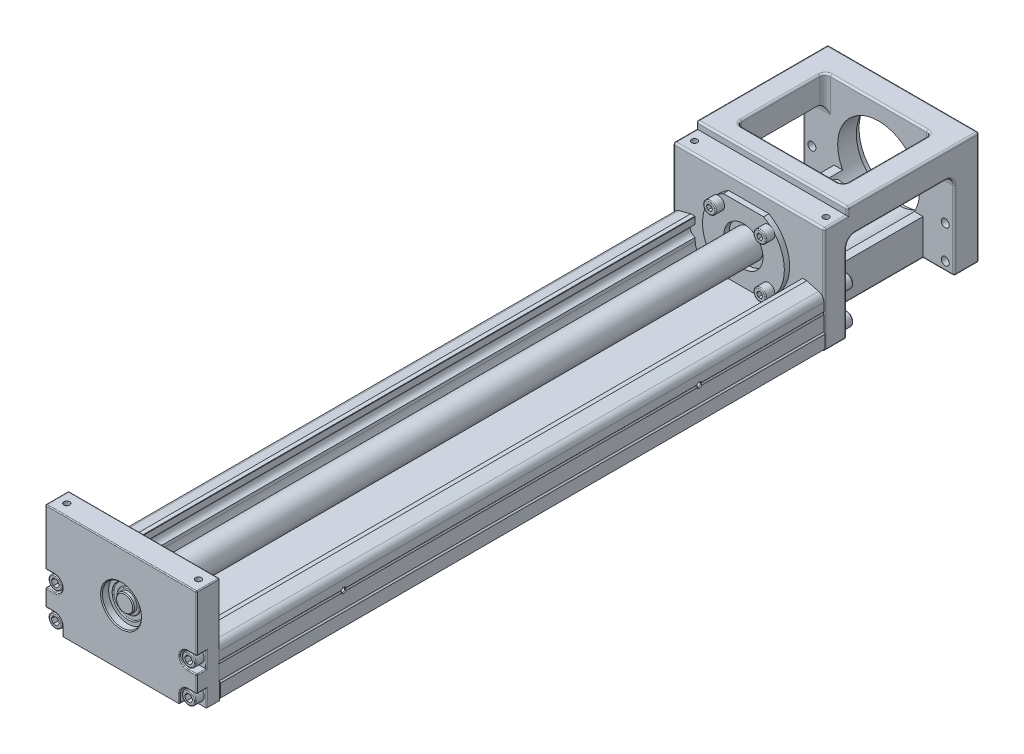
SolidWorks part; units mm, degrees
ref_plane "前视基准面" through (0, 0, 0) normal (0, 0, 1) x (1, 0, 0)
ref_plane "上视基准面" through (0, 0, 0) normal (0, 1, 0) x (1, 0, 0)
ref_plane "右视基准面" through (0, 0, 0) normal (1, 0, 0) x (0, 0, -1)
sketch "草图1" plane through (0, 0, 0) normal (0, 0, 1) x (1, 0, 0)
  line L0 (0, 0) -> (0, 14.97) construction
  line L1 (-11, 0.5) -> (11, 0.5)
  line L2 (11, 0.5) -> (11, 0)
  line L3 (11, 0) -> (33, 0) construction
  line L4 (33, 0) -> (33, 0.5)
  line L5 (33, 0.5) -> (41.5, 0.5)
  line L6 (43, 2) -> (43, 9.25) construction
  line L7 (43, 9.25) -> (42.25, 10)
  line L8 (42.25, 10) -> (42.25, 24.345)
  line L9 (39.2853, 28.2087) -> (32.6, 30)
  line L10 (32.6, 30) -> (30.1, 30) construction
  line L11 (30.1, 30) -> (30.1, 17.9)
  line L12 (30.1, 30) -> (30.1, 30.15)
  line L13 (13, 9.9) -> (-13, 9.9)
  line L14 (41.5, 0.5) -> (43, 2)
  line L15 (-41.5, 0.5) -> (-43, 2)
  line L16 (30.1, 30.15) -> (32.0402, 30.15)
  line L17 (-30.1, 30) -> (-30.1, 17.9)
  line L18 (-32.6, 30) -> (-30.1, 30) construction
  line L19 (-39.2853, 28.2087) -> (-32.6, 30)
  line L20 (-42.25, 10) -> (-42.25, 24.345)
  line L21 (-43, 9.25) -> (-42.25, 10)
  line L22 (-43, 2) -> (-43, 9.25) construction
  line L23 (-33, 0.5) -> (-41.5, 0.5)
  line L24 (-33, 0) -> (-33, 0.5)
  line L25 (-11, 0) -> (-33, 0) construction
  line L26 (-11, 0.5) -> (-11, 0)
  line L27 (13, 9.9) -> (22.1, 9.9)
  line L28 (32.0402, 30.15) -> (32.6, 30)
  line L29 (-13, 9.9) -> (-22.1, 9.9)
  line L30 (43, 9.25) -> (43.15, 9.1)
  line L31 (43.15, 9.1) -> (43.15, 2.15)
  line L32 (43.15, 2.15) -> (43, 2)
  line L33 (33, 0) -> (33, -0.5)
  line L34 (33, -0.5) -> (11, -0.5)
  line L35 (11, -0.5) -> (11, 0)
  line L36 (-11, -0.5) -> (-11, 0)
  line L37 (-33, -0.5) -> (-11, -0.5)
  line L38 (-33, 0) -> (-33, -0.5)
  line L39 (-43.15, 2.15) -> (-43, 2)
  line L40 (-43.15, 9.1) -> (-43.15, 2.15)
  line L41 (-43, 9.25) -> (-43.15, 9.1)
  line L42 (-30.1, 30) -> (-30.1, 30.15)
  line L43 (-30.1, 30.15) -> (-32.0402, 30.15)
  line L44 (-32.0402, 30.15) -> (-32.6, 30)
  arc A0 (42.25, 24.345) -> (39.2853, 28.2087) centre (38.25, 24.345) ccw
  arc A1 (-22.1, 9.9) -> (-30.1, 17.9) centre (-22.1, 17.9) cw
  arc A2 (22.1, 9.9) -> (30.1, 17.9) centre (22.1, 17.9) ccw
  arc A3 (-42.25, 24.345) -> (-39.2853, 28.2087) centre (-38.25, 24.345) cw
  point P9 (43, 0.5)
  point P24 (0, 0.5)
  point P25 (0, 9.9)
  point P40 (-43, 0.5)
  dimension "D16" = 4
  dimension "D17" = 13
  dimension "D15" = 8
  dimension "D1" = 0.5
  dimension "D2" = 0.5
  dimension "D3" = 43
  dimension "D4" = 42.25
  dimension "D5" = 2.5
  dimension "D6" = 30
  dimension "D7" = 15
  dimension "D8" = 9.4
  dimension "D9" = 22
  dimension "D10" = 11
  dimension "D11" = 10
  dimension "D12" = 45
  dimension "D13" = 30.1
  dimension "D14" = 13
  dimension "D19" = 22.1
  dimension "D20" = 22.1
  dimension "D21" = 0.5
  dimension "D22" = 0.15
  dimension "D23" = 0.15
extrude "总长" add sketch "草图1" along normal blind 340
sketch "草图2" plane through (0, 0, 0) normal (0, 0, -1) x (-1, 0, 0)
  line L0 (-33.1974, 23) -> (30.685, 23) construction
  line L1 (0, 0) -> (0, 24.2172) construction
  line L2 (-29.7, 23) -> (-31.9451, 25.2451) construction
  line L4 (-22.1, 9.9) -> (22.1, 9.9) construction
  line L5 (-30.1, 30.15) -> (-30.1, 17.9) construction
  line L6 (-32.8, 22.7) -> (-32.8, 23.3)
  line L7 (-32.6, 23.5) -> (-32.3495, 23.5)
  line L8 (-29.6116, 22.9116) -> (-32.6, 23.3) construction
  line L9 (-32.6, 23.3) -> (-32.8841, 23.3369) construction
  line L10 (-32.6, 22.5) -> (-32.3495, 22.5)
  line L11 (32.6, 22.5) -> (32.3495, 22.5)
  line L12 (32.8, 22.7) -> (32.8, 23.3)
  line L13 (32.6, 23.5) -> (32.3495, 23.5)
  circle A0 centre (-29.7, 23) radius 3.175 construction
  arc A1 (-26.3128, 23) -> (-32.9104, 23) centre (-29.6116, 22.9116) ccw construction
  arc A2 (-26.3128, 23) -> (-32.9104, 23) centre (-29.6116, 23.0884) cw construction
  arc A3 (26.3128, 23) -> (32.9104, 23) centre (29.6116, 23.0884) ccw construction
  arc A4 (26.3128, 23) -> (32.9104, 23) centre (29.6116, 22.9116) cw construction
  arc A5 (-32.3495, 22.5) -> (-32.3495, 23.5) centre (-29.9, 23) ccw
  arc A6 (-32.8, 23.3) -> (-32.6, 23.5) centre (-32.6, 23.3) cw
  arc A7 (-32.8, 22.7) -> (-32.6, 22.5) centre (-32.6, 22.7) ccw
  arc A8 (32.8, 22.7) -> (32.6, 22.5) centre (32.6, 22.7) cw
  arc A9 (32.8, 23.3) -> (32.6, 23.5) centre (32.6, 23.3) ccw
  arc A10 (32.3495, 22.5) -> (32.3495, 23.5) centre (29.9, 23) cw
  point P20 (-31.5649, 24.8649)
  point P21 (-30.1, 26.1753)
  point P22 (-30.1, 25.492)
  point P31 (-32.7983, 23.3258)
  point P33 (-32.8, 23)
  dimension "D2" = 6.35
  dimension "D5" = 6.6
  dimension "D6" = 5
  dimension "D10" = 0.2
  dimension "D1" = 13.1
  dimension "D3" = 59.4
  dimension "D4" = 45
  dimension "D7" = 59.8
  dimension "D8" = 0.5376
  dimension "D9" = 0.6833
  dimension "D11" = 1
  dimension "D12" = 65.6
  dimension "D13" = 0.0865
extrude "预拉滚道" cut sketch "草图2" against normal through all
hole_wizard "cekong" positions "草图4" profile "草图3" tap size "M2.5" standard "GB"
sketch "草图4" plane through (-42.25, 0, 0) normal (-1, 0, 0) x (0, 0, 1)
  line L2 (0, 24.345) -> (0, 10) construction
  point P0 (70, 19)
  dimension "D3" = 19
  dimension "ckdj" = 70
sketch "草图3" plane through (-42.25, 19, 70) normal (0, 1, 0) x (0, 0, 1)
  line L0 (0, 0) -> (0, 6.1159)
  line L1 (0, 6.1159) -> (1.025, 5.5)
  line L2 (1.025, 5.5) -> (1.025, 0.475)
  line L3 (1.025, 0.475) -> (1.5, 0)
  line L5 (1.5, 0) -> (0, 0)
  line L6 (-1.025, 0.475) -> (-1.5, 0) construction
  line L10 (0, 6.1159) -> (-1.025, 5.5) construction
  line L11 (0, -6.35) -> (0, 107.95) construction
  dimension "螺纹孔钻头直径" = 2.05
  dimension "螺纹孔钻头深度" = 5.5
  dimension "近端锥形沉头孔直径" = 3
  dimension "近端锥形沉头孔角度" = 90
  dimension "导头角度" = 118
pattern_linear "ckzl" count 2 spacing 200 along (0, 0, 1) of "cekong"
mirror "镜向3" about plane through (0, 0, 0) normal (1, 0, 0) of "ckzl", "cekong"
hole_wizard "dikong" positions "草图6" profile "草图5" counterbore size "M6" standard "GB"
sketch "草图6" plane through (6.505, 30.15, 0) normal (0, 1, 0) x (1, 0, 0)
  line L1 (15.595, 0) -> (-28.605, 0) construction
  point P0 (-29.505, -70)
  dimension "D2" = 23
  dimension "dkdj" = 70
sketch "草图5" plane through (-23, 30.15, 70) normal (1, 0, 0) x (0, 0, 1)
  line L0 (0, 0) -> (0, 30.65)
  line L1 (3.3, 29.95) -> (4, 30.65)
  line L2 (3.3, 29.95) -> (3.3, 25.65)
  line L3 (3.3, 25.65) -> (5.5, 25.65)
  line L4 (5.5, 25.65) -> (5.5, 0)
  line L5 (5.5, 0) -> (0, 0)
  line L11 (0, -6.35) -> (0, 107.95) construction
  line L12 (4, 30.65) -> (0, 30.65)
  line L13 (-3.3, 29.95) -> (-4, 30.65) construction
  dimension "通孔孔直径" = 6.6
  dimension "通孔孔深度" = 30.65
  dimension "柱形沉头孔直径" = 11
  dimension "柱形沉头孔深度" = 25.65
  dimension "远端锥形沉头孔直径" = 8
  dimension "远端锥形沉头孔角度" = 90
pattern_linear "dkzl" count 3 spacing 100 along (0, 0, 1) count 2 spacing 46 along (1, 0, 0) of "dikong"
ref_plane "基准面1" through (0, 0, 170) normal (0, 0, 1) x (1, 0, 0)
sketch "草图9" plane through (0, 0, 0) normal (0, 0, -1) x (-1, 0, 0)
  line L0 (42.25, 24.345) -> (42.25, 10) construction
  line L2 (0, 0) -> (0, 25.541) construction
  line L3 (36.1341, 19) -> (47.0239, 19) construction
  line L5 (40.5408, 6) -> (48.9402, 6) construction
  line L8 (42.7, 5.25) -> (51.3153, 5.25)
  line L9 (42.5, 5.45) -> (42.5, 6.55)
  line L10 (42.7, 6.75) -> (51.3153, 6.75)
  line L11 (51.3153, 5.25) -> (51.3153, 6.75)
  line L12 (42.5, 5.25) -> (51.3153, 6.75) construction
  line L13 (42.5, 6.75) -> (51.3153, 5.25) construction
  circle A0 centre (43.6, 6) radius 1 construction
  circle A1 centre (42.95, 19) radius 1
  circle A2 centre (-42.95, 19) radius 1
  arc A3 (42.7, 5.25) -> (42.5, 5.45) centre (42.7, 5.45) cw
  arc A4 (42.5, 6.55) -> (42.7, 6.75) centre (42.7, 6.55) cw
  point P20 (46.9077, 6)
  dimension "D1" = 2
  dimension "D4" = 2
  dimension "D8" = 0.2
  dimension "D2" = 87.2
  dimension "D3" = 13
  dimension "D5" = 0.7
  dimension "D6" = 1.5
  dimension "D7" = 85
extrude "标识槽" cut sketch "草图9" against normal through all
chamfer "倒角1" distance 0.35 angle 45 2 edges at (-30.1, 30.15, 170) (30.1, 30.15, 170)
chamfer "倒角2" distance 1 angle 45 4 edges at (-11, -0.5, 170) (-33, -0.5, 170) (11, -0.5, 170) (33, -0.5, 170)
sketch "草图11" plane through (0, 0, 0) normal (0, 0, -1) x (-1, 0, 0)
  line L0 (-32.0402, 30.15) -> (-30.45, 30.15) construction
  line L1 (-43, 30) -> (43, 30)
  line L2 (-43, 30) -> (-43, 0)
  line L3 (-43, 0) -> (43, 0)
  line L4 (43, 30) -> (43, 0)
  line L5 (-43.15, 2.15) -> (-43.15, 9.1) construction
  line L6 (43.15, 5.25) -> (43.15, 2.15) construction
  line L7 (32, -0.5) -> (12, -0.5) construction
  dimension "D1" = 0.15
  dimension "D2" = 0.15
  dimension "D3" = 0.15
  dimension "D4" = 0.5
extrude "切除-拉伸3" cut sketch "草图11" against normal through all flip side to cut
sketch "草图12" plane through (0, 0, 0) normal (0, 0, -1) x (-1, 0, 0)
  line L0 (0, 0) -> (0, 23) construction
  line L1 (0, 23) -> (-51.3359, 23) construction
  line L2 (-32.5, 0) -> (-11.5, 0) construction
  line L3 (-29.7, 23) -> (-31.9451, 25.2451)
  circle A0 centre (-29.7, 23) radius 3.175 construction
  arc A1 (-26.2025, 23) -> (-32.9281, 23) centre (-29.5653, 22.8653) ccw
  arc A2 (-26.2025, 23) -> (-32.9281, 23) centre (-29.5653, 23.1347) cw
  arc A3 (26.2025, 23) -> (32.9281, 23) centre (29.5653, 22.8653) cw
  arc A4 (26.2025, 23) -> (32.9281, 23) centre (29.5653, 23.1347) ccw
extrude "切除-拉伸4" cut sketch "草图12" against normal through all
sketch "草图13" plane through (0, 0, 0) normal (0, 0, -1) x (-1, 0, 0)
  line L0 (0, 0) -> (0, 45.4622) construction
  line L1 (-42.5, 64) -> (42.5, 64)
  line L2 (-42.5, 64) -> (-42.5, 0.5)
  line L3 (-42.5, 0.5) -> (42.5, 0.5)
  line L4 (42.5, 64) -> (42.5, 0.5)
  line L5 (11, 0.5) -> (-11, 0.5) construction
  dimension "D1" = 85
  dimension "D2" = 63.5
extrude "凸台-拉伸1" add sketch "草图13" along normal blind 87 separate body
sketch "草图15" plane through (42.5, 0, 0) normal (1, 0, 0) x (0, 0, -1)
  line L0 (0, 64) -> (0, 0.5) construction
  line L1 (12.5, 0.5) -> (73, 0.5)
  line L3 (12.5, 49.5) -> (73, 49.5)
  line L4 (73, 0.5) -> (73, 49.5)
  line L6 (12.5, 0.5) -> (12.5, 49.5)
  line L8 (87, 0.5) -> (0, 0.5) construction
  point P0 (23, 0.5)
  point P2 (23, 49.5)
  point P9 (15, 49.5)
  point P10 (15, 54.7868)
  point P11 (73, 30.5)
  dimension "D1" = 12.5
  dimension "D2" = 60.5
  dimension "D3" = 49
extrude "切除-拉伸5" cut sketch "草图15" against normal blind 17.5
sketch "草图16" plane through (-42.5, 0, 0) normal (-1, 0, 0) x (0, 0, 1)
  line L6 (-73, 49.5) -> (-73, 0.5)
  line L7 (-12.5, 49.5) -> (-73, 49.5)
  line L10 (-12.5, 0.5) -> (-12.5, 49.5)
  line L11 (-73, 0.5) -> (-12.5, 0.5)
  line L12 (-73, 49.5) -> (-73, 0.5)
  line L13 (-12.5, 49.5) -> (-73, 49.5)
  line L16 (-12.5, 0.5) -> (-12.5, 49.5)
  line L17 (-73, 0.5) -> (-12.5, 0.5)
  dimension "D1" = 0
extrude "切除-拉伸6" cut sketch "草图16" against normal blind 17.5
sketch "草图18" plane through (0, 0, -87) normal (0, 0, -1) x (-1, 0, 0)
  line L0 (0, 0) -> (0, 32) construction
  circle A0 centre (0, 32) radius 23
  dimension "D1" = 46
  dimension "D2" = 32
extrude "切除-拉伸7" cut sketch "草图18" against normal blind 64
sketch "草图19" plane through (0, 0, -87) normal (0, 0, -1) x (-1, 0, 0)
  circle A0 centre (0, 32) radius 25
  dimension "D1" = 50
extrude "切除-拉伸8" cut sketch "草图19" against normal blind 3.5
sketch "草图20" plane through (0, 64, 0) normal (0, 1, 0) x (1, 0, 0)
  line L0 (0, 87) -> (0, -17.8608) construction
  line L1 (-42.5, 87) -> (42.5, 87) construction
  line L2 (-25, 73) -> (-42.5, 73) construction
  line L3 (-30, 73) -> (30, 73)
  line L4 (-30, 73) -> (-30, 23)
  line L5 (-30, 23) -> (30, 23)
  line L6 (30, 73) -> (30, 23)
  line L7 (23, 23) -> (-23, 23) construction
  dimension "D1" = 60
extrude "切除-拉伸9" cut sketch "草图20" against normal blind 43
fillet "圆角1" radius 3 4 edges at (-30, 56.75, -23) (-30, 56.75, -73) (30, 56.75, -73) (30, 56.75, -23)
fillet "圆角2" radius 5 4 edges at (34.75, 49.5, -73) (-34.75, 49.5, -73) (33.75, 49.5, -12.5) (-33.75, 49.5, -12.5)
sketch "草图22" plane through (42.5, 0, 0) normal (1, 0, 0) x (0, 0, -1)
  line L1 (0, 64) -> (13, 64)
  line L2 (0, 64) -> (0, 60)
  line L3 (0, 60) -> (13, 60)
  line L4 (13, 64) -> (13, 60)
  dimension "D1" = 13
  dimension "D2" = 4
extrude "切除-拉伸10" cut sketch "草图22" against normal through all
sketch "草图23" plane through (0, 0, -23) normal (0, 0, -1) x (-1, 0, 0)
  circle A0 centre (0, 32) radius 11
  dimension "D1" = 22
extrude "切除-拉伸11" cut sketch "草图23" against normal blind 5.5
sketch "草图24" plane through (0, 0, -17.5) normal (0, 0, -1) x (-1, 0, 0)
  circle A0 centre (0, 32) radius 8.5
  dimension "D1" = 17
extrude "凸台-拉伸3" add sketch "草图24" along normal blind 6
sketch "草图25" plane through (0, 0, -23.5) normal (0, 0, -1) x (-1, 0, 0)
  circle A0 centre (0, 32) radius 6
  dimension "D1" = 12
extrude "凸台-拉伸4" add sketch "草图25" along normal blind 7.5
sketch "草图26" plane through (0, 0, -23.5) normal (0, 0, -1) x (-1, 0, 0)
  line L0 (0, 32) -> (0, 49.8509) construction
  line L1 (-2.7964, 42.6386) -> (-10.6386, 34.7964)
  line L2 (-10.6386, 29.2036) -> (-2.7964, 21.3614)
  line L3 (2.7964, 21.3614) -> (10.6386, 29.2036)
  line L4 (10.6386, 34.7964) -> (2.7964, 42.6386)
  circle A0 centre (0, 32) radius 9.5 construction
  arc A1 (-10.6386, 34.7964) -> (-10.6386, 29.2036) centre (0, 32) ccw
  arc A4 (-2.7964, 21.3614) -> (2.7964, 21.3614) centre (0, 32) ccw
  arc A5 (10.6386, 29.2036) -> (10.6386, 34.7964) centre (0, 32) ccw
  arc A6 (2.7964, 42.6386) -> (-2.7964, 42.6386) centre (0, 32) ccw
  point P14 (-1.5, 41)
  point P15 (-1.5, 21)
  point P18 (1.5, 41)
  point P19 (1.5, 21)
  dimension "D1" = 19
  dimension "D2" = 22
extrude "凸台-拉伸5" add sketch "草图26" along normal blind 6.5 separate body
sketch "草图27" plane through (0, 0, -31) normal (0, 0, -1) x (-1, 0, 0)
  circle A0 centre (0, 32) radius 5
  dimension "D1" = 10
extrude "凸台-拉伸6" add sketch "草图27" along normal blind 20
fillet "圆角3" radius 1 42 edges at (42.5, 22.5, -12.5) (42.5, 49.5, -42.75) (42.5, 48.0355, -71.5355) (-42.5, 22.5, -12.5) (-42.5, 49.5, -42.75) (-42.5, 48.0355, -71.5355) (-42.5, 30.25, 0) (42.5, 30.25, 0) (42.5, 0.5, -6.25) (-42.5, 0.5, -6.25) (-42.5, 0.5, -80) (42.5, 0.5, -80) (0, 0.5, -87) (42.5, 22.5, -73) (42.5, 32.25, -87) (-42.5, 22.5, -73) (-42.5, 32.25, -87) (42.5, 60, -6.5) (42.5, 62, -13) (0, 60, 0) (0, 64, -13) (-42.5, 62, -13) (-42.5, 60, -6.5) (-42.5, 64, -50) (0, 64, -87) (42.5, 64, -50) (-33.75, 0.5, -12.5) (-25, 0.5, -42.75) (-33.75, 0.5, -73) (33.75, 0.5, -73) (25, 0.5, -42.75) (33.75, 0.5, -12.5) (42.5, 48.0355, -13.9645) (-42.5, 48.0355, -13.9645) (29.1213, 64, -23.8787) (0, 64, -23) (-29.1213, 64, -23.8787) (-30, 64, -48) (-29.1213, 64, -72.1213) (0, 64, -73) (29.1213, 64, -72.1213) (30, 64, -48)
sketch "草图28" plane through (0, 0, 340) normal (0, 0, 1) x (1, 0, 0)
  line L0 (-41.5, 0.5) -> (-33, 0.5) construction
  line L1 (-42.5, 0.5) -> (42.5, 0.5)
  line L2 (-42.5, 0.5) -> (-42.5, 60)
  line L3 (-42.5, 60) -> (42.5, 60)
  line L4 (42.5, 0.5) -> (42.5, 60)
  line L5 (-42.5, 1.5) -> (-42.5, 59) construction
  line L6 (-41.5, 60) -> (41.5, 60) construction
  line L7 (42.5, 59) -> (42.5, 1.5) construction
extrude "凸台-拉伸7" add sketch "草图28" along normal blind 13
hole_wizard "M4 螺纹孔1" positions "草图30" profile "草图29" tap size "M4" standard "GB"
sketch "草图30" plane through (0, 60, 0) normal (0, 1, 0) x (1, 0, 0)
  line L0 (0, 86) -> (0, -353) construction
  line L1 (41.5, 86) -> (-41.5, 86) construction
  line L2 (42.5, -353) -> (-42.5, -353) construction
  line L4 (-41.5, 13) -> (41.5, 13) construction
  point P0 (-37, -346.5)
  point P2 (37, -346.5)
  point P4 (-37, 6.5)
  point P6 (37, 6.5)
  dimension "D1" = 74
  dimension "D2" = 6.5
  dimension "D3" = 6.5
sketch "草图29" plane through (-37, 60, 346.5) normal (1, 0, 0) x (0, 0, 1)
  line L0 (0, 0) -> (0, 11.0914)
  line L1 (0, 11.0914) -> (1.65, 10.1)
  line L2 (1.65, 10.1) -> (1.65, 0)
  line L5 (1.65, 0) -> (0, 0)
  line L10 (0, 11.0914) -> (-1.65, 10.1) construction
  line L11 (0, -6.35) -> (0, 107.95) construction
  dimension "螺纹孔钻头直径" = 3.3
  dimension "螺纹孔钻头深度" = 10.1
  dimension "导头角度" = 118
sketch "草图32" plane through (0, 0, 0) normal (0, 0, 1) x (1, 0, 0)
  circle A0 centre (0, 32) radius 8
  dimension "D1" = 16
extrude "凸台-拉伸8" add sketch "草图32" along normal up to surface (340 mm away)
sketch "草图33" plane through (0, 0, 353) normal (0, 0, 1) x (1, 0, 0)
  circle A0 centre (0, 32) radius 11
extrude "切除-拉伸12" cut sketch "草图33" against normal blind 4
sketch "草图34" plane through (0, 0, 349) normal (0, 0, 1) x (1, 0, 0)
  circle A0 centre (0, 32) radius 5
  dimension "D1" = 10
extrude "凸台-拉伸9" add sketch "草图34" along normal blind 2
sketch "草图35" plane through (0, 0, 353) normal (0, 0, 1) x (1, 0, 0)
  line L0 (0, 32) -> (0, 0) construction
  line L1 (-11.5, 0) -> (-32.5, 0) construction
  line L2 (-42.5, 60) -> (-42.5, 0.5) construction
  line L3 (42.5, 0.5) -> (42.5, 60) construction
  line L4 (-42.5, 28.5) -> (-42.5, 19.5)
  line L5 (42.5, 0.5) -> (42.5, 10)
  line L6 (-37.5, 28.5) -> (-42.5, 28.5)
  line L7 (-37.5, 19.5) -> (-42.5, 19.5)
  line L8 (-37.5, 10) -> (-42.5, 10)
  line L9 (-33, 5.5) -> (-33, 0.5)
  line L10 (-42.5, 0.5) -> (-33, 0.5)
  line L11 (-42.5, 10) -> (-42.5, 0.5)
  line L12 (37.5, 28.5) -> (42.5, 28.5)
  line L13 (37.5, 19.5) -> (42.5, 19.5)
  line L14 (37.5, 10) -> (42.5, 10)
  line L15 (33, 5.5) -> (33, 0.5)
  line L16 (33, 0.5) -> (42.5, 0.5)
  line L17 (-42.5, 0.5) -> (42.5, 0.5) construction
  line L18 (42.5, 19.5) -> (42.5, 28.5)
  arc A0 (-37.5, 19.5) -> (-37.5, 28.5) centre (-37.5, 24) ccw
  arc A1 (-33, 5.5) -> (-37.5, 10) centre (-37.5, 5.5) ccw
  arc A2 (37.5, 28.5) -> (37.5, 19.5) centre (37.5, 24) ccw
  arc A3 (37.5, 10) -> (33, 5.5) centre (37.5, 5.5) ccw
  dimension "D1" = 75
  dimension "D2" = 5.5
  dimension "D3" = 18.5
  dimension "D4" = 9
extrude "切除-拉伸13" cut sketch "草图35" against normal blind 5.5
sketch "草图36" plane through (0, 0, 347.5) normal (0, 0, 1) x (1, 0, 0)
  circle A0 centre (-37.5, 24) radius 3.75
  circle A1 centre (-37.5, 5.5) radius 3.75
  circle A2 centre (37.5, 5.5) radius 3.75
  circle A3 centre (37.5, 24) radius 3.75
  dimension "D1" = 7.5
extrude "凸台-拉伸10" add sketch "草图36" along normal blind 5
sketch "草图37" plane through (0, 0, 352.5) normal (0, 0, 1) x (1, 0, 0)
  line L1 (-36.3453, 26) -> (-38.6547, 26)
  line L2 (-38.6547, 26) -> (-39.8094, 24)
  line L3 (-39.8094, 24) -> (-38.6547, 22)
  line L4 (-38.6547, 22) -> (-36.3453, 22)
  line L5 (-36.3453, 22) -> (-35.1906, 24)
  line L6 (-35.1906, 24) -> (-36.3453, 26)
  line L7 (-36.3453, 7.5) -> (-38.6547, 7.5)
  line L8 (-38.6547, 7.5) -> (-39.8094, 5.5)
  line L9 (-39.8094, 5.5) -> (-38.6547, 3.5)
  line L10 (-38.6547, 3.5) -> (-36.3453, 3.5)
  line L11 (-36.3453, 3.5) -> (-35.1906, 5.5)
  line L12 (-35.1906, 5.5) -> (-36.3453, 7.5)
  line L13 (36.3453, 7.5) -> (35.1906, 5.5)
  line L14 (35.1906, 5.5) -> (36.3453, 3.5)
  line L15 (36.3453, 3.5) -> (38.6547, 3.5)
  line L16 (38.6547, 3.5) -> (39.8094, 5.5)
  line L17 (39.8094, 5.5) -> (38.6547, 7.5)
  line L18 (38.6547, 7.5) -> (36.3453, 7.5)
  line L19 (36.3453, 26) -> (35.1906, 24)
  line L20 (35.1906, 24) -> (36.3453, 22)
  line L21 (36.3453, 22) -> (38.6547, 22)
  line L22 (38.6547, 22) -> (39.8094, 24)
  line L23 (39.8094, 24) -> (38.6547, 26)
  line L24 (38.6547, 26) -> (36.3453, 26)
  circle A0 centre (-37.5, 24) radius 2 construction
  circle A1 centre (-37.5, 5.5) radius 2 construction
  circle A2 centre (37.5, 5.5) radius 2 construction
  circle A3 centre (37.5, 24) radius 2 construction
  dimension "D1" = 4
extrude "切除-拉伸14" cut sketch "草图37" against normal blind 3.5
fillet "圆角4" radius 0.5 39 edges at (40, 28.5, 353) (33, 24, 353) (33, 3, 353) (34.318, 8.682, 353) (-33, 3, 353) (-40, 10, 353) (-40, 28.5, 353) (-33, 24, 353) (-42.5, 34.875, 340) (42.5, 34.875, 340) (42.5, 14.75, 353) (42.5, 44.25, 353) (42.5, 60, 346.5) (0, 60, 340) (-42.5, 60, 346.5) (0, 60, 353) (-42.5, 19.5, 350.25) (-42.5, 24, 347.5) (-42.5, 28.5, 350.25) (33, 0.5, 350.25) (42.5, 10, 350.25) (42.5, 5.25, 347.5) (42.5, 19.5, 350.25) (42.5, 24, 347.5) (42.5, 28.5, 350.25) (-33, 0.5, 350.25) (-37.75, 0.5, 347.5) (-42.5, 5.25, 347.5) (-42.5, 10, 350.25) (-42.5, 14.75, 353) (-42.5, 44.25, 353) (41.25, 24, 352.5) (40, 19.5, 353) (40, 10, 353) (41.25, 5.5, 352.5) (-34.318, 8.682, 353) (-40, 19.5, 353) (-33.75, 24, 352.5) (-33.75, 5.5, 352.5)
sketch "草图38" plane through (0, 0, -87) normal (0, 0, -1) x (-1, 0, 0)
  circle A0 centre (-37.5, 24) radius 2.25
  circle A1 centre (-37.5, 5.5) radius 2.25
  circle A2 centre (37.5, 5.5) radius 2.25
  circle A3 centre (37.5, 24) radius 2.25
  dimension "D1" = 4.5
extrude "切除-拉伸15" cut sketch "草图38" against normal blind 23.5
sketch "草图39" plane through (0, 0, -12.5) normal (0, 0, -1) x (-1, 0, 0)
  circle A0 centre (37.5, 24) radius 3.75 construction
  circle A1 centre (37.5, 5.5) radius 3.75 construction
  circle A2 centre (-37.5, 24) radius 3.75 construction
  circle A3 centre (-37.5, 5.5) radius 3.75 construction
  circle A4 centre (37.5, 24) radius 3.75
  circle A5 centre (37.5, 5.5) radius 3.75
  circle A6 centre (-37.5, 24) radius 3.75
  circle A7 centre (-37.5, 5.5) radius 3.75
extrude "凸台-拉伸11" add sketch "草图39" along normal blind 5
sketch "草图40" plane through (0, 0, -17.5) normal (0, 0, -1) x (-1, 0, 0)
  line L0 (35.1906, 24) -> (36.3453, 26) construction
  line L1 (36.3453, 26) -> (38.6547, 26) construction
  line L2 (38.6547, 26) -> (39.8094, 24) construction
  line L3 (39.8094, 24) -> (38.6547, 22) construction
  line L4 (38.6547, 22) -> (36.3453, 22) construction
  line L5 (36.3453, 22) -> (35.1906, 24) construction
  line L6 (35.1906, 5.5) -> (36.3453, 7.5) construction
  line L7 (36.3453, 7.5) -> (38.6547, 7.5) construction
  line L8 (38.6547, 7.5) -> (39.8094, 5.5) construction
  line L9 (39.8094, 5.5) -> (38.6547, 3.5) construction
  line L10 (38.6547, 3.5) -> (36.3453, 3.5) construction
  line L11 (36.3453, 3.5) -> (35.1906, 5.5) construction
  line L12 (-38.6547, 26) -> (-36.3453, 26) construction
  line L13 (-36.3453, 26) -> (-35.1906, 24) construction
  line L14 (-35.1906, 24) -> (-36.3453, 22) construction
  line L15 (-36.3453, 22) -> (-38.6547, 22) construction
  line L16 (-38.6547, 22) -> (-39.8094, 24) construction
  line L17 (-39.8094, 24) -> (-38.6547, 26) construction
  line L18 (-38.6547, 7.5) -> (-36.3453, 7.5) construction
  line L19 (-36.3453, 7.5) -> (-35.1906, 5.5) construction
  line L20 (-35.1906, 5.5) -> (-36.3453, 3.5) construction
  line L21 (-36.3453, 3.5) -> (-38.6547, 3.5) construction
  line L22 (-38.6547, 3.5) -> (-39.8094, 5.5) construction
  line L23 (-39.8094, 5.5) -> (-38.6547, 7.5) construction
  line L24 (35.1906, 24) -> (36.3453, 26)
  line L25 (36.3453, 26) -> (38.6547, 26)
  line L26 (38.6547, 26) -> (39.8094, 24)
  line L27 (39.8094, 24) -> (38.6547, 22)
  line L28 (38.6547, 22) -> (36.3453, 22)
  line L29 (36.3453, 22) -> (35.1906, 24)
  line L30 (35.1906, 5.5) -> (36.3453, 7.5)
  line L31 (36.3453, 7.5) -> (38.6547, 7.5)
  line L32 (38.6547, 7.5) -> (39.8094, 5.5)
  line L33 (39.8094, 5.5) -> (38.6547, 3.5)
  line L34 (38.6547, 3.5) -> (36.3453, 3.5)
  line L35 (36.3453, 3.5) -> (35.1906, 5.5)
  line L36 (-38.6547, 26) -> (-36.3453, 26)
  line L37 (-36.3453, 26) -> (-35.1906, 24)
  line L38 (-35.1906, 24) -> (-36.3453, 22)
  line L39 (-36.3453, 22) -> (-38.6547, 22)
  line L40 (-38.6547, 22) -> (-39.8094, 24)
  line L41 (-39.8094, 24) -> (-38.6547, 26)
  line L42 (-38.6547, 7.5) -> (-36.3453, 7.5)
  line L43 (-36.3453, 7.5) -> (-35.1906, 5.5)
  line L44 (-35.1906, 5.5) -> (-36.3453, 3.5)
  line L45 (-36.3453, 3.5) -> (-38.6547, 3.5)
  line L46 (-38.6547, 3.5) -> (-39.8094, 5.5)
  line L47 (-39.8094, 5.5) -> (-38.6547, 7.5)
extrude "切除-拉伸16" cut sketch "草图40" against normal blind 3
fillet "圆角5" radius 0.5 4 edges at (-37.5, 27.75, -17.5) (-37.5, 9.25, -17.5) (37.5, 9.25, -17.5) (37.5, 27.75, -17.5)
hole_wizard "M4 螺纹孔2" positions "草图42" profile "草图41" tap size "M4" standard "GB"
sketch "草图42" plane through (0, 0, -87) normal (0, 0, -1) x (-1, 0, 0)
  line L0 (-25, 32) -> (0, 32) construction
  line L1 (0, 32) -> (0, 57) construction
  line L3 (-25.9808, 47) -> (25.9808, 17) construction
  line L5 (25.9808, 47) -> (-25.9808, 17) construction
  circle A0 centre (0, 32) radius 25 construction
  circle A1 centre (0, 32) radius 25 construction
  circle A2 centre (0, 32) radius 30
  point P0 (-25.9808, 47)
  point P2 (-25.9808, 17)
  point P4 (25.9808, 17)
  point P6 (25.9808, 47)
  dimension "D1" = 30
  dimension "D3" = 60
  dimension "D2" = 30
sketch "草图41" plane through (25.9808, 47, -87) normal (1, 0, 0) x (0, 1, 0)
  line L0 (0, 0) -> (0, 11.0914)
  line L1 (0, 11.0914) -> (1.65, 10.1)
  line L2 (1.65, 10.1) -> (1.65, 0)
  line L5 (1.65, 0) -> (0, 0)
  line L10 (0, 11.0914) -> (-1.65, 10.1) construction
  line L11 (0, -6.35) -> (0, 107.95) construction
  dimension "螺纹孔钻头直径" = 3.3
  dimension "螺纹孔钻头深度" = 10.1
  dimension "导头角度" = 118
hole_wizard "M5 螺纹孔1" positions "草图44" profile "草图43" tap size "M5" standard "GB"
sketch "草图44" plane through (0, 0, -87) normal (0, 0, -1) x (-1, 0, 0)
  line L0 (0, 67) -> (0, 32) construction
  line L1 (0, 32) -> (-35, 32) construction
  line L3 (-24.7487, 56.7487) -> (24.7487, 7.2513) construction
  line L5 (24.7487, 56.7487) -> (-24.7487, 7.2513) construction
  circle A0 centre (0, 32) radius 35 construction
  point P0 (-24.7487, 56.7487)
  point P14 (24.7487, 7.2513)
  point P17 (24.7487, 56.7487)
  point P18 (-24.7487, 7.2513)
  dimension "D1" = 45
  dimension "D3" = 70
  dimension "D2" = 45
sketch "草图43" plane through (24.7487, 56.7487, -87) normal (1, 0, 0) x (0, 1, 0)
  line L0 (0, 0) -> (0, 13.6618)
  line L1 (0, 13.6618) -> (2.1, 12.4)
  line L2 (2.1, 12.4) -> (2.1, 0)
  line L5 (2.1, 0) -> (0, 0)
  line L10 (0, 13.6618) -> (-2.1, 12.4) construction
  line L11 (0, -6.35) -> (0, 107.95) construction
  dimension "螺纹孔钻头直径" = 4.2
  dimension "螺纹孔钻头深度" = 12.4
  dimension "导头角度" = 118
sketch "草图45" plane through (0, 0.5, 0) normal (0, -1, 0) x (1, 0, 0)
  line L0 (0, -87) -> (0, 0) construction
  line L1 (41.5, -87) -> (-41.5, -87) construction
  line L2 (-25, -42.75) -> (25, -42.75) construction
  line L3 (-25, -73) -> (-25, -12.5) construction
  line L4 (25, -12.5) -> (25, -73) construction
  line L6 (-18, -26.75) -> (18, -26.75)
  line L7 (-21, -29.75) -> (-21, -55.75)
  line L8 (-18, -58.75) -> (18, -58.75)
  line L9 (21, -29.75) -> (21, -55.75)
  arc A0 (21, -29.75) -> (18, -26.75) centre (18, -29.75) ccw
  arc A1 (18, -58.75) -> (21, -55.75) centre (18, -55.75) ccw
  arc A2 (-18, -58.75) -> (-21, -55.75) centre (-18, -55.75) cw
  arc A3 (-21, -29.75) -> (-18, -26.75) centre (-18, -29.75) cw
  dimension "D1" = 3
  dimension "D2" = 32
  dimension "D3" = 42
extrude "切除-拉伸17" cut sketch "草图45" against normal blind 0.5
sketch "草图47" plane through (0, 0, 0) normal (0, 0, 1) x (1, 0, 0)
  line L0 (-23, 32) -> (23, 32) construction
  line L1 (-11.3578, 12) -> (11.3578, 12)
  line L2 (-11.3578, 52) -> (11.3578, 52)
  line L4 (-23, 52) -> (23, 52) construction
  line L5 (-23, 12) -> (23, 12) construction
  arc A0 (-11.3578, 52) -> (-11.3578, 12) centre (0, 32) ccw
  arc A1 (11.3578, 12) -> (11.3578, 52) centre (0, 32) ccw
  circle A2 centre (0, 32) radius 11
  dimension "D1" = 20
  dimension "D3" = 23
  dimension "D4" = 22
  dimension "D2" = 20
extrude "凸台-拉伸13" add sketch "草图47" along normal blind 3
sketch "草图48" plane through (0, 0, 3) normal (0, 0, 1) x (1, 0, 0)
  line L0 (0, 52) -> (0, 32) construction
  line L1 (0, 32) -> (-20, 32) construction
  line L2 (-14.1421, 46.1421) -> (14.1421, 17.8579) construction
  line L3 (14.1421, 46.1421) -> (-14.1421, 17.8579) construction
  circle A0 centre (0, 32) radius 20 construction
  circle A1 centre (-14.1421, 46.1421) radius 3.5
  circle A2 centre (14.1421, 46.1421) radius 3.5
  circle A3 centre (14.1421, 17.8579) radius 3.5
  circle A4 centre (-14.1421, 17.8579) radius 3.5
  dimension "D1" = 40
  dimension "D4" = 7
  dimension "D2" = 45
  dimension "D3" = 45
extrude "凸台-拉伸14" add sketch "草图48" along normal blind 5
sketch "草图49" plane through (0, 0, 8) normal (0, 0, 1) x (1, 0, 0)
  line L1 (-12.4101, 46.1421) -> (-13.2761, 47.6421)
  line L2 (-13.2761, 47.6421) -> (-15.0082, 47.6421)
  line L3 (-15.0082, 47.6421) -> (-15.8742, 46.1421)
  line L4 (-15.8742, 46.1421) -> (-15.0082, 44.6421)
  line L5 (-15.0082, 44.6421) -> (-13.2761, 44.6421)
  line L6 (-13.2761, 44.6421) -> (-12.4101, 46.1421)
  line L7 (15.0082, 47.6421) -> (13.2761, 47.6421)
  line L8 (13.2761, 47.6421) -> (12.4101, 46.1421)
  line L9 (12.4101, 46.1421) -> (13.2761, 44.6421)
  line L10 (13.2761, 44.6421) -> (15.0082, 44.6421)
  line L11 (15.0082, 44.6421) -> (15.8742, 46.1421)
  line L12 (15.8742, 46.1421) -> (15.0082, 47.6421)
  line L13 (13.2761, 19.3579) -> (12.4101, 17.8579)
  line L14 (12.4101, 17.8579) -> (13.2761, 16.3579)
  line L15 (13.2761, 16.3579) -> (15.0082, 16.3579)
  line L16 (15.0082, 16.3579) -> (15.8742, 17.8579)
  line L17 (15.8742, 17.8579) -> (15.0082, 19.3579)
  line L18 (15.0082, 19.3579) -> (13.2761, 19.3579)
  line L19 (-13.2761, 19.3579) -> (-15.0082, 19.3579)
  line L20 (-15.0082, 19.3579) -> (-15.8742, 17.8579)
  line L21 (-15.8742, 17.8579) -> (-15.0082, 16.3579)
  line L22 (-15.0082, 16.3579) -> (-13.2761, 16.3579)
  line L23 (-13.2761, 16.3579) -> (-12.4101, 17.8579)
  line L24 (-12.4101, 17.8579) -> (-13.2761, 19.3579)
  circle A0 centre (-14.1421, 46.1421) radius 1.5 construction
  circle A1 centre (14.1421, 46.1421) radius 1.5 construction
  circle A2 centre (14.1421, 17.8579) radius 1.5 construction
  circle A3 centre (-14.1421, 17.8579) radius 1.5 construction
  dimension "D1" = 3
extrude "切除-拉伸18" cut sketch "草图49" against normal blind 3
fillet "圆角6" radius 0.5 4 edges at (17.6421, 17.8579, 8) (-10.6421, 17.8579, 8) (17.6421, 46.1421, 8) (-10.6421, 46.1421, 8)
sketch "草图50" plane through (0, 0, 349) normal (0, 0, 1) x (1, 0, 0)
  circle A0 centre (0, 32) radius 6.5
  circle A1 centre (0, 32) radius 9
  dimension "D1" = 13
  dimension "D2" = 18
extrude "切除-拉伸19" cut sketch "草图50" against normal blind 0.5
chamfer "倒角3" distance 0.5 angle 45 2 edges at (5, 32, 351) (11, 32, 353)
fillet "圆角7" radius 0.5 2 edges at (6.5, 32, 349) (9, 32, 348.5)
hole_wizard "Ø8.0 (8) 直径孔1" positions "草图52" profile "草图51" hole size "Ø8.0" standard "ISO"
sketch "草图52" plane through (0, 0, 340) normal (0, 0, -1) x (-1, 0, 0)
  circle A0 centre (0, 32) radius 8 construction
  point P0 (-17, 40)
  dimension "D1" = 17
  dimension "D2" = 8
sketch "草图51" plane through (17, 40, 340) normal (1, 0, 0) x (0, 1, 0)
  line L0 (0, 0) -> (0, 10.4034)
  line L1 (0, 10.4034) -> (4, 8)
  line L2 (4, 8) -> (4, 0.5)
  line L3 (4, 0.5) -> (4.5, 0)
  line L5 (4.5, 0) -> (0, 0)
  line L6 (-4, 0.5) -> (-4.5, 0) construction
  line L10 (0, 10.4034) -> (-4, 8) construction
  line L11 (0, -6.35) -> (0, 107.95) construction
  dimension "孔直径" = 8
  dimension "孔深度" = 8
  dimension "近端锥形沉头孔直径" = 9
  dimension "近端锥形沉头孔角度" = 90
  dimension "导头角度" = 118
equation "\"D4@草图12\"=6.35*1.06"
